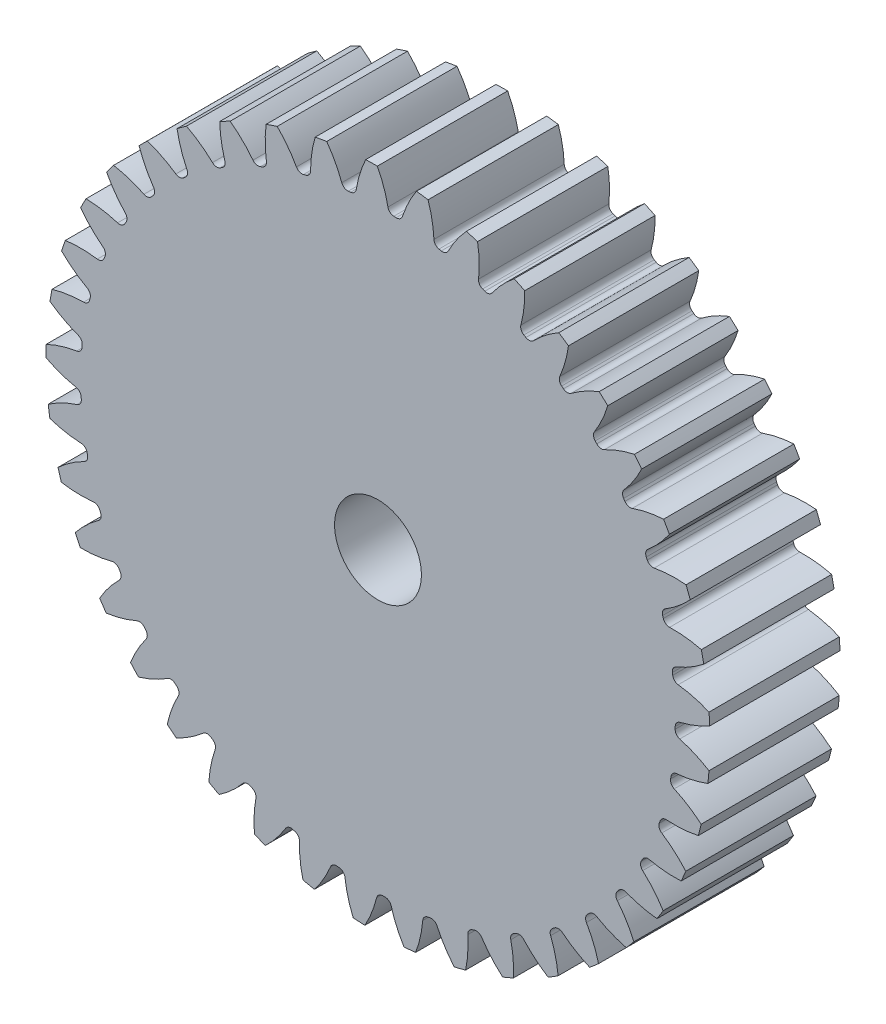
SolidWorks part; units mm, degrees
ref_plane "Front" through (0, 0, 0) normal (0, 0, 1) x (1, 0, 0)
ref_plane "Top" through (0, 0, 0) normal (0, 1, 0) x (1, 0, 0)
ref_plane "Right" through (0, 0, 0) normal (1, 0, 0) x (0, 0, -1)
sketch "Sketch3" plane through (0, 0, 0) normal (0, 0, 1) x (1, 0, 0)
  circle A0 centre (0, 0) radius 242.7111
  dimension "od" = 485.4222
extrude "gearBody" add sketch "Sketch3" along normal blind 95.25
sketch "Sketch2" plane through (0, 0, 0) normal (0, 0, 1) x (1, 0, 0)
  line L0 (0, 0) -> (200.9122, 83.2205) construction
  line L1 (242.1681, -18.9887) -> (0, 0) construction
  line L2 (0, 0) -> (36.3143, 0) construction
  line L3 (231.3789, 4.4777) -> (231.0465, -13.182) construction
  line L5 (231.2127, -4.3521) -> (0, 0) construction
  line L7 (0, 0) -> (217.4658, 0) construction
  arc A0 (217.4653, 0.4277) -> (217.2952, -8.6113) centre (0, 0) ccw construction
  arc A1 (242.5152, 9.7505) -> (241.9764, -18.8702) centre (0, 0) ccw construction
  arc A2 (231.3789, 4.4777) -> (231.0465, -13.182) centre (0, 0) ccw construction
  arc A3 (217.2548, -4.9471) -> (217.2871, -3.2323) centre (0, 0) ccw
  arc A4 (242.1681, -18.9887) -> (220.5987, -9.4731) centre (197.638, -90.7225) ccw
  arc A5 (242.1681, -18.9887) -> (242.7111, 9.8618) centre (0, 0) ccw
  arc A6 (242.7111, 9.8618) -> (220.7989, 1.1646) centre (200.9122, 83.2205) cw
  arc A7 (217.2871, -3.2323) -> (220.7989, 1.1646) centre (221.8811, -3.3007) cw
  arc A8 (220.5987, -9.4731) -> (217.2548, -4.9471) centre (221.8482, -5.0517) cw
  point P6 (242.7111, 9.8618)
  point P22 (242.1681, -18.9887)
  dimension "baseDia" = 434.9315
  dimension "od" = 485.4222
  dimension "pd" = 462.8444
  dimension "rd" = 434.6222
  dimension "rFillet" = 4.5946
  dimension "pointX" = 242.7111
  dimension "pointY" = 9.8618
  dimension "CTT" = 17.6597
  dimension "flankCenterAngle" = 22.5
extrude "toothCut" cut sketch "Sketch2" along normal through all
pattern_circular "CirPattern1" count 41 over 360 about axis through (0, 0, 0) along (0, 0, 1) of "toothCut"
sketch "hub1Dia" plane through (0, 0, 0) normal (0, 0, -1) x (-1, 0, 0)
  circle A0 centre (0, 0) radius 12.7
  dimension "hub1Dia" = 25.4
sketch "hub2Dia" plane through (0, 0, 95.25) normal (0, 0, 1) x (1, 0, 0)
  circle A0 centre (0, 0) radius 12.7
  dimension "hub2dia" = 25.4
sketch "boreDia" plane through (0, 0, 0) normal (0, 0, 1) x (1, 0, 0)
  circle A0 centre (0, 0) radius 31.75
  dimension "boreDia" = 63.5
extrude "bore" cut sketch "boreDia" against normal mid plane 25400
